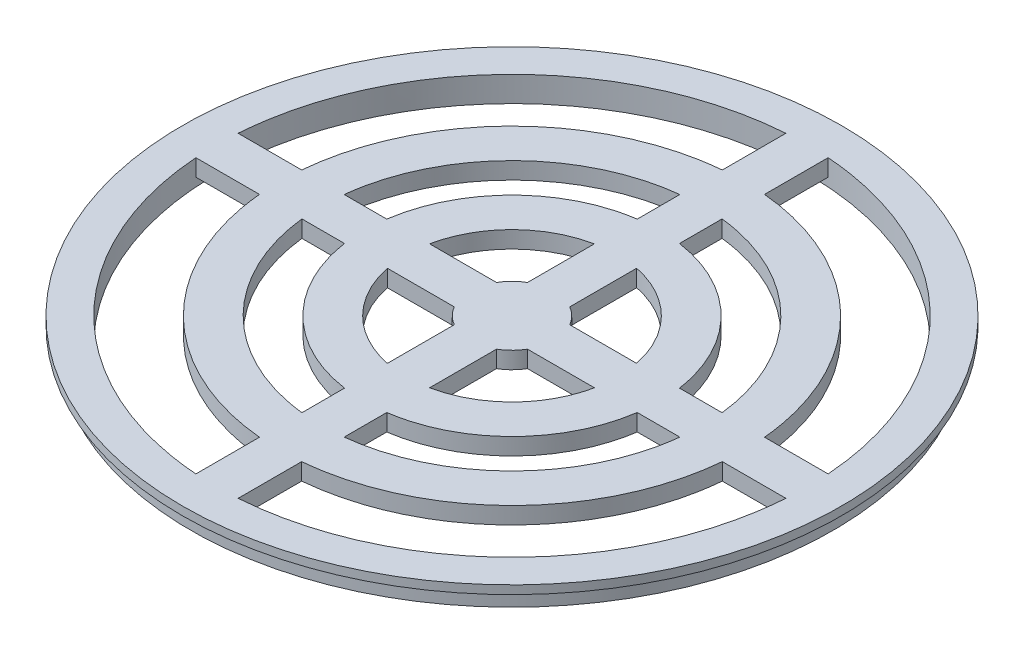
SolidWorks part; units mm, degrees
ref_plane "Front Plane" through (0, 0, 0) normal (0, 0, 1) x (1, 0, 0)
ref_plane "Top Plane" through (0, 0, 0) normal (0, 1, 0) x (1, 0, 0)
ref_plane "Right Plane" through (0, 0, 0) normal (1, 0, 0) x (0, 0, -1)
sketch "Sketch1" plane through (0, 0, 0) normal (0, 1, 0) x (1, 0, 0)
  circle A0 centre (0, 0) radius 39
extrude "Boss-Extrude1" add sketch "Sketch1" along normal blind 1
sketch "Sketch2" plane through (0, 0, 0) normal (0, -1, 0) x (1, 0, 0)
  circle A0 centre (0, 0) radius 38
extrude "Boss-Extrude2" add sketch "Sketch2" along normal blind 2
sketch "Sketch4" plane through (0, 1, 0) normal (0, 1, 0) x (1, 0, 0)
  line L0 (0, 35) -> (0, -35)
  line L1 (-35, 0) -> (35, 0)
  circle A0 centre (0, 0) radius 5
  circle A1 centre (0, 0) radius 15
  circle A2 centre (0, 0) radius 25
  circle A3 centre (0, 0) radius 35
other "Vent2" parameters "RibsDepth"=2, "RibsWidth"=5, "RibsOffset"=0, "SparsDepth"=2, "SparsWidth"=5, "SparsOffset"=0, "SupportDepth"=2, "SupportOffset"=0, "Draft"=1
equation "\"diameter\"=80"
equation "\"thick\"=2"
equation "\"D1@Sketch1\"=\"diameter\"-\"thick\""
equation "\"D1@Boss-Extrude1\"=\"thick\"/2"
equation "\"D1@Sketch2\"=\"diameter\"-2*(\"thick\")"
equation "\"D1@Boss-Extrude2\"=\"thick\""
equation "\"air cavity\"= 10"
equation "\"D1@Sketch4\"=\"air cavity\""
equation "\"D2@Sketch4\"=\"air cavity\""
equation "\"D3@Sketch4\"=\"air cavity\""
equation "\"D4@Sketch4\"=\"air cavity\""
